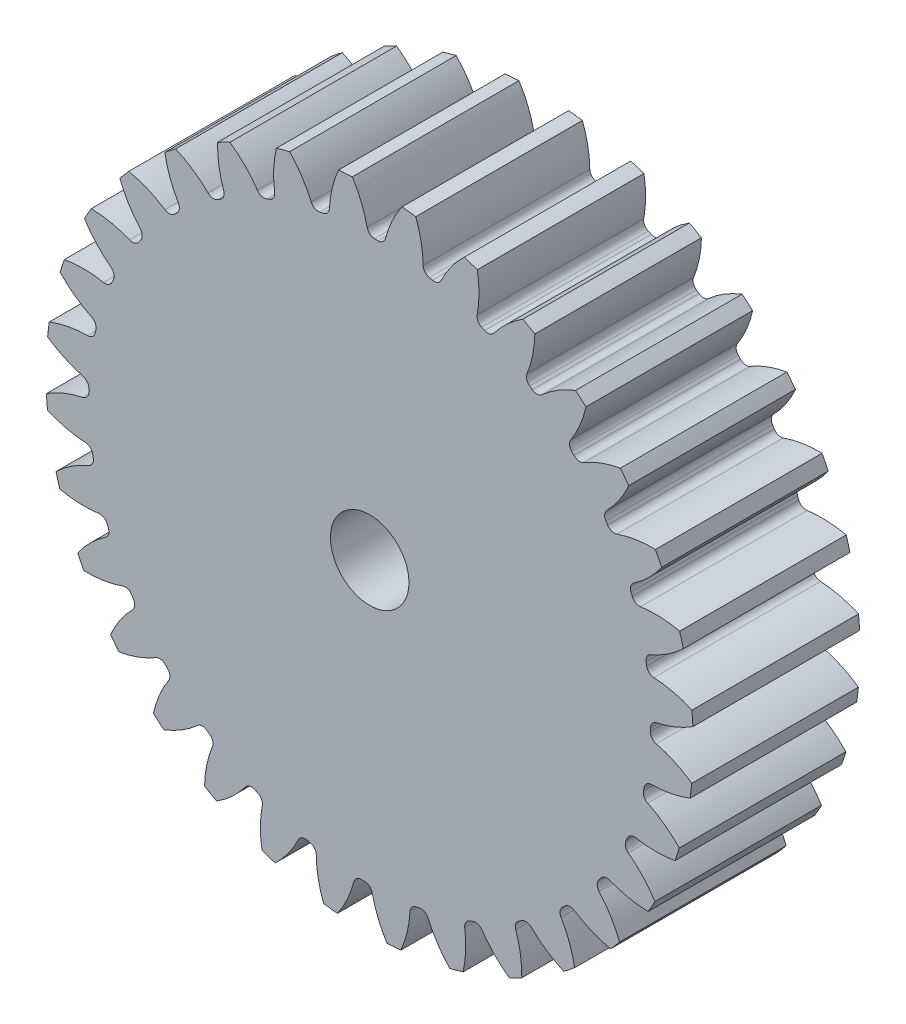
SolidWorks part; units mm, degrees
ref_plane "Front" through (0, 0, 0) normal (0, 0, 1) x (1, 0, 0)
ref_plane "Top" through (0, 0, 0) normal (0, 1, 0) x (1, 0, 0)
ref_plane "Right" through (0, 0, 0) normal (1, 0, 0) x (0, 0, -1)
sketch "Sketch3" plane through (0, 0, 0) normal (0, 0, 1) x (1, 0, 0)
  circle A0 centre (0, 0) radius 172.72
  dimension "od" = 345.44
extrude "gearBody" add sketch "Sketch3" along normal blind 88.9
sketch "Sketch2" plane through (0, 0, 0) normal (0, 0, 1) x (1, 0, 0)
  line L0 (0, 0) -> (141.1285, 58.4574) construction
  line L1 (172.0993, -17.4056) -> (0, 0) construction
  line L2 (0, 0) -> (36.3143, 0) construction
  line L3 (162.5059, 4.1926) -> (162.1383, -11.7011) construction
  line L5 (162.3221, -3.7543) -> (0, 0) construction
  line L7 (0, 0) -> (152.7564, 0) construction
  arc A0 (152.7509, 1.3034) -> (152.5273, -8.364) centre (0, 0) ccw construction
  arc A1 (172.471, 9.2709) -> (171.858, -17.2347) centre (0, 0) ccw construction
  arc A2 (162.5059, 4.1926) -> (162.1383, -11.7011) centre (0, 0) ccw construction
  arc A3 (149.7973, -4.335) -> (149.8375, -2.5951) centre (0, 0) ccw
  arc A4 (172.0993, -17.4056) -> (152.8942, -8.4577) centre (138.275, -64.9195) ccw
  arc A5 (172.0993, -17.4056) -> (172.72, 9.4305) centre (0, 0) ccw
  arc A6 (172.72, 9.4305) -> (153.1217, 1.38) centre (141.1285, 58.4574) cw
  arc A7 (149.8375, -2.5951) -> (153.1217, 1.38) centre (153.972, -2.6667) cw
  arc A8 (152.8942, -8.4577) -> (149.7973, -4.335) centre (153.9307, -4.4546) cw
  point P6 (172.72, 9.4305)
  point P22 (172.0993, -17.4056)
  dimension "baseDia" = 305.5129
  dimension "od" = 345.44
  dimension "pd" = 325.12
  dimension "rd" = 299.72
  dimension "rFillet" = 4.1351
  dimension "pointX" = 172.72
  dimension "pointY" = 9.4305
  dimension "CTT" = 15.8937
  dimension "flankCenterAngle" = 22.5
extrude "toothCut" cut sketch "Sketch2" along normal through all
pattern_circular "CirPattern1" count 32 over 360 about axis through (0, 0, 0) along (0, 0, 1) of "toothCut"
sketch "hub1Dia" plane through (0, 0, 0) normal (0, 0, -1) x (-1, 0, 0)
  circle A0 centre (0, 0) radius 12.7
  dimension "hub1Dia" = 25.4
sketch "hub2Dia" plane through (0, 0, 88.9) normal (0, 0, 1) x (1, 0, 0)
  circle A0 centre (0, 0) radius 12.7
  dimension "hub2dia" = 25.4
sketch "boreDia" plane through (0, 0, 0) normal (0, 0, 1) x (1, 0, 0)
  circle A0 centre (0, 0) radius 20.955
  dimension "boreDia" = 41.91
extrude "bore" cut sketch "boreDia" against normal mid plane 25400
